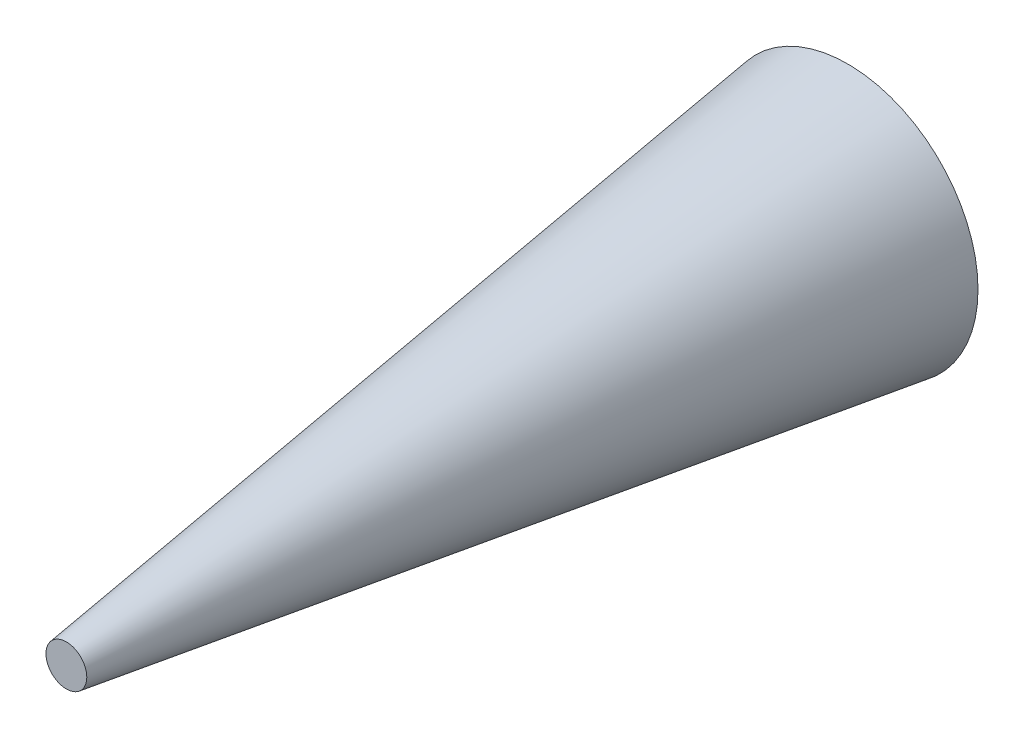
SolidWorks part; units mm, degrees
ref_plane "Front Plane" through (0, 0, 0) normal (0, 0, 1) x (1, 0, 0)
ref_plane "Top Plane" through (0, 0, 0) normal (0, 1, 0) x (1, 0, 0)
ref_plane "Right Plane" through (0, 0, 0) normal (1, 0, 0) x (0, 0, -1)
sketch "Sketch1" plane through (0, 0, 0) normal (0, 0, 1) x (1, 0, 0)
  circle A0 centre (0, 0) radius 10
  dimension "D1" = 20
extrude "Boss-Extrude1" add sketch "Sketch1" along normal blind 60 draft 8
